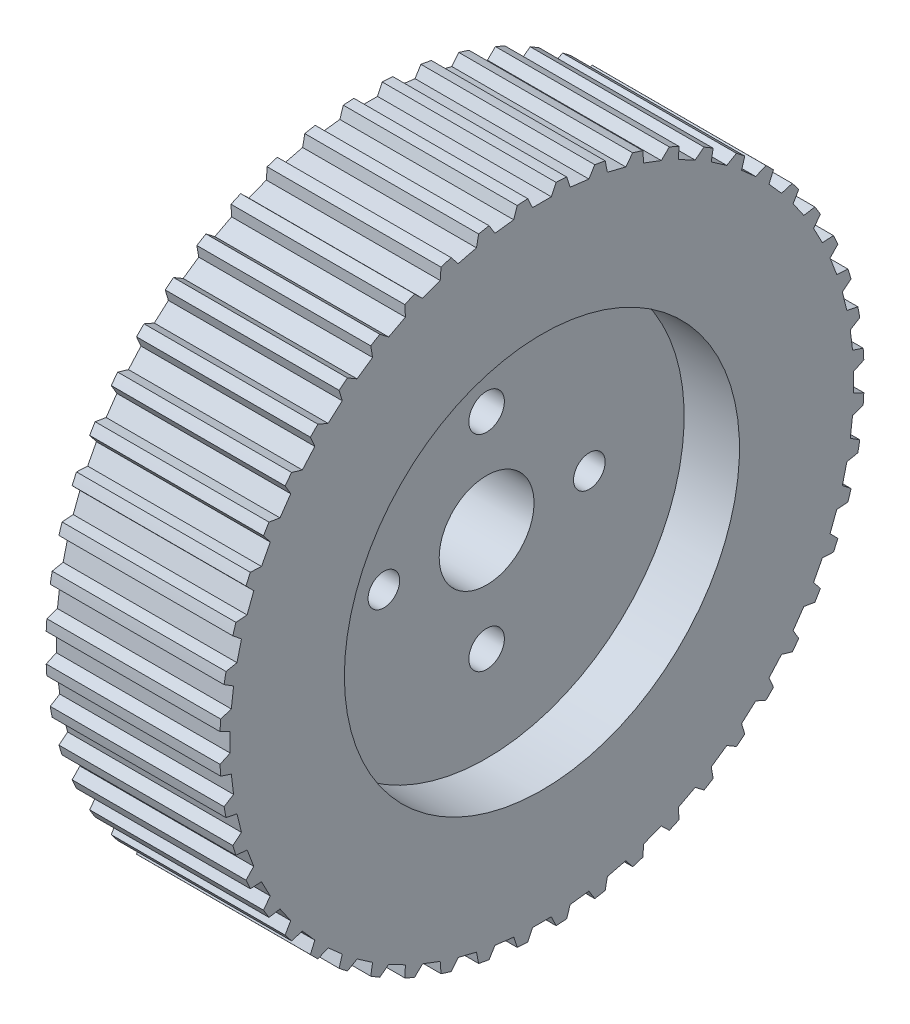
SolidWorks part; units mm, degrees
ref_plane "Plan de face" through (0, 0, 0) normal (0, 0, 1) x (1, 0, 0)
ref_plane "Plan de dessus" through (0, 0, 0) normal (0, 1, 0) x (1, 0, 0)
ref_plane "Plan de droite" through (0, 0, 0) normal (1, 0, 0) x (0, 0, -1)
sketch "Esquisse1" plane through (0, 0, 0) normal (0, 0, 1) x (1, 0, 0)
  line L0 (0, 25) -> (7, 25)
  line L1 (7, 25) -> (7, 40.77)
  line L2 (7, 40.77) -> (-15, 40.77)
  line L3 (-15, 40.77) -> (-15, 6)
  line L4 (-15, 6) -> (0, 6)
  line L5 (0, 6) -> (0, 25)
  line L6 (-40.0082, 0) -> (33.5204, 0) construction
  dimension "D1" = 50
  dimension "D2" = 12
  dimension "D3" = 81.54
  dimension "D4" = 22
  dimension "D5" = 7
revolve "Révolution1" add sketch "Esquisse1" angle 360 about L6
sketch "Esquisse2" plane through (-15, 0, 0) normal (-1, 0, 0) x (0, 0, 1)
  line L0 (-24.9453, 0) -> (26.01, 0) construction
  line L1 (0, 23.1961) -> (0, -23.1961) construction
  circle A0 centre (0, 13) radius 2.25
  circle A1 centre (13, 0) radius 2
  circle A2 centre (0, -13) radius 2.25
  circle A3 centre (-13, 0) radius 2
  dimension "D1" = 4.5
  dimension "D2" = 4
  dimension "D3" = 13
  dimension "D4" = 13
extrude "Enlèv. mat.-Extru.1" cut sketch "Esquisse2" against normal through all
sketch "Esquisse3" plane through (-15, 0, 0) normal (-1, 0, 0) x (0, 0, 1)
  line L0 (-2.15, 41.5) -> (-1.1941, 39.45)
  line L1 (-1.1941, 39.45) -> (1.1941, 39.45)
  line L2 (1.1941, 39.45) -> (2.15, 41.5)
  line L3 (2.15, 41.5) -> (-2.15, 41.5)
  line L4 (0, 0) -> (0, 52.9558) construction
  dimension "D1" = 50
  dimension "D2" = 41.5
  dimension "D3" = 2.05
  dimension "D4" = 4.3
  dimension "D5" = 2.15
  dimension "D6" = 25
extrude "Enlèv. mat.-Extru.2" cut sketch "Esquisse3" against normal through all
pattern_circular "Répétition circulaire1" count 52 every 6.923 about axis through (0, 0, 0) along (1, 0, 0) of "Enlèv. mat.-Extru.2"
